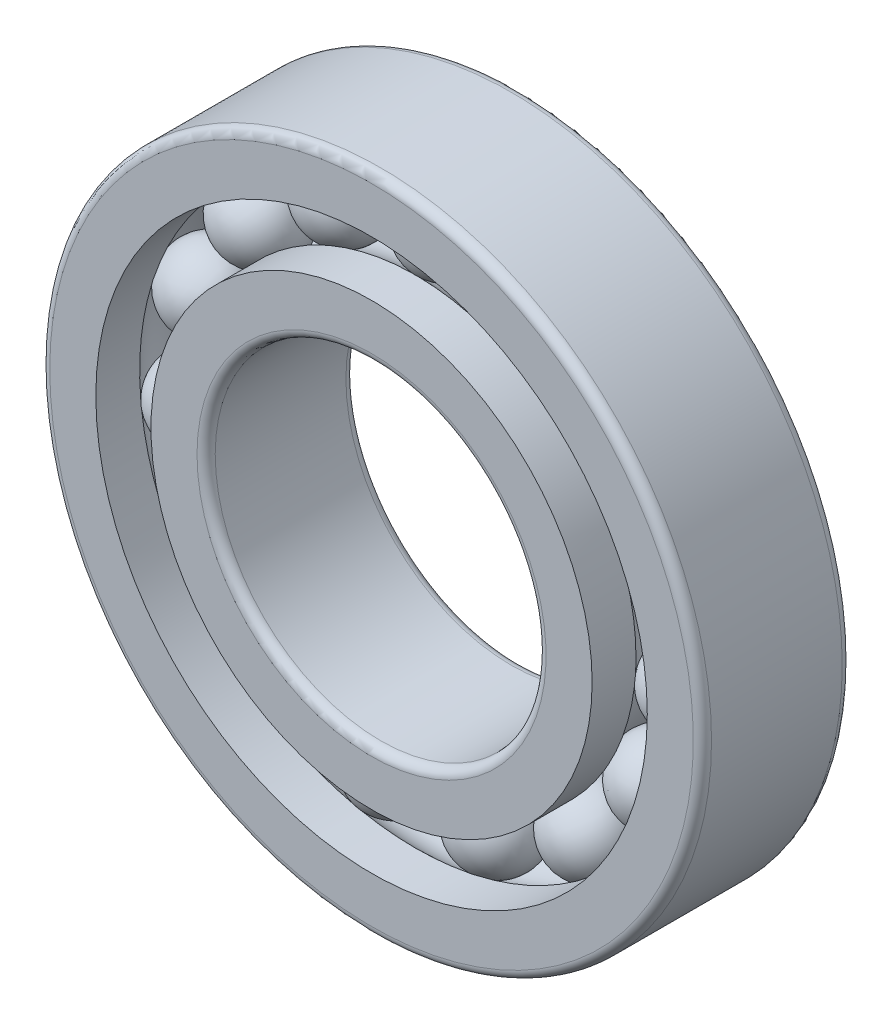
SolidWorks part; units mm, degrees
ref_plane "Front Plane" through (0, 0, 0) normal (0, 0, 1) x (1, 0, 0)
ref_plane "Top Plane" through (0, 0, 0) normal (0, 1, 0) x (1, 0, 0)
ref_plane "Right Plane" through (0, 0, 0) normal (1, 0, 0) x (0, 0, -1)
other "Configuration Table"
sketch "BaseSke" plane through (0, 0, 0) normal (1, 0, 0) x (0, 0, -1)
  line L0 (-47.2296, 0) -> (24.6132, 0) construction
  line L1 (-47.2296, 30) -> (24.6132, 30) construction
  line L2 (0, 129.5214) -> (0, -86.3012) construction
  line L3 (0, 35) -> (0, 25)
  line L4 (-9, 40) -> (9, 40) construction
  line L5 (-9, 20) -> (9, 20) construction
  arc A0 (0, 35) -> (0, 25) centre (0, 30) ccw
revolve "Ball" add sketch "BaseSke" angle 360 about L3
sketch "OuterRaceSke" plane through (0, 0, 0) normal (1, 0, 0) x (0, 0, -1)
  line L0 (0, 0) -> (0, 87.5396) construction
  line L1 (-9, 40) -> (9, 40)
  line L2 (-9, 40) -> (-9, 33.3333)
  line L3 (-9, 33.3333) -> (-3.7012, 33.3333)
  line L4 (9, 40) -> (9, 33.3333)
  line L5 (-50.3916, 0) -> (55.2197, 0) construction
  line L6 (-47.2296, 30) -> (24.6132, 30) construction
  line L7 (3.7012, 33.3333) -> (9, 33.3333)
  arc A0 (3.7012, 33.3333) -> (-3.7012, 33.3333) centre (0, 30) ccw
revolve "OuterRace" add sketch "OuterRaceSke" angle 360 about L5
sketch "InnerRaceSke" plane through (0, 0, 0) normal (1, 0, 0) x (0, 0, -1)
  line L0 (-70.8626, 0) -> (113.5527, 0) construction
  line L1 (0, 58.441) -> (0, -70.8113) construction
  line L2 (-9, 20) -> (9, 20)
  line L3 (-9, 20) -> (-9, 26.6667)
  line L4 (-9, 26.6667) -> (-3.7012, 26.6667)
  line L5 (9, 20) -> (9, 26.6667)
  line L6 (0, 129.5214) -> (0, -86.3012) construction
  line L7 (3.7012, 26.6667) -> (9, 26.6667)
  arc A0 (-3.7012, 26.6667) -> (3.7012, 26.6667) centre (0, 30) ccw
  arc A1 (0, 35) -> (0, 25) centre (0, 30) ccw construction
revolve "InnerRace" add sketch "InnerRaceSke" angle 360 about L0
fillet "Fillet1" radius 1.1 4 edges at (20, 0, -9) (20, 0, 9) (40, 0, -9) (40, 0, 9)
pattern_circular "CirPatternBall" count 15 over 360 about axis through (0, 0, 0) along (0, 0, 1) of "Ball"
sketch "SimplifiedSke" plane through (0, 0, 0) normal (1, 0, 0) x (0, 0, -1)
  line L0 (37.5911, 0) -> (-37.5911, 0) construction
  circle A0 centre (0, 30) radius 5
  arc A1 (0, 35) -> (0, 25) centre (0, 30) ccw construction
revolve "Simplified" [suppressed] add sketch "SimplifiedSke" angle 360 about L0
equation "\"D1@BaseSke\" =  (\"Bearing_Outside_Diameter@BaseSke\"  +  \"Bearing_Inside_Diameter@BaseSke\"  )  / 4"
equation "\"Ball_diameter@BaseSke\" =  ( \"Bearing_Outside_Diameter@BaseSke\" - \"Bearing_Inside_Diameter@BaseSke\" ) / 4 "
equation "\"D2@OuterRaceSke\" = \"Bearing_Outside_Diameter@BaseSke\" -  ( \"Bearing_Outside_Diameter@BaseSke\" - \"Bearing_Inside_Diameter@BaseSke\" )  / 3"
equation "\"D4@OuterRaceSke\" = (  \"Bearing_Outside_Diameter@BaseSke\" - \"Bearing_Inside_Diameter@BaseSke\" ) / 4 -0.02-\"Bearing_Thickness@BaseSke\" * 0.001"
equation "\"D1@InnerRaceSke\" = \"Bearing_Inside_Diameter@BaseSke\" +  ( \"Bearing_Outside_Diameter@BaseSke\" - \"Bearing_Inside_Diameter@BaseSke\" )  / 3"
equation "\"D2@InnerRaceSke\" = \"D4@OuterRaceSke\""
equation "\"D1@CirPatternBall\" = int( (  \"D1@BaseSke\"* pi  * 2 / \"Ball_diameter@BaseSke\"  ) * 0.8 )"
